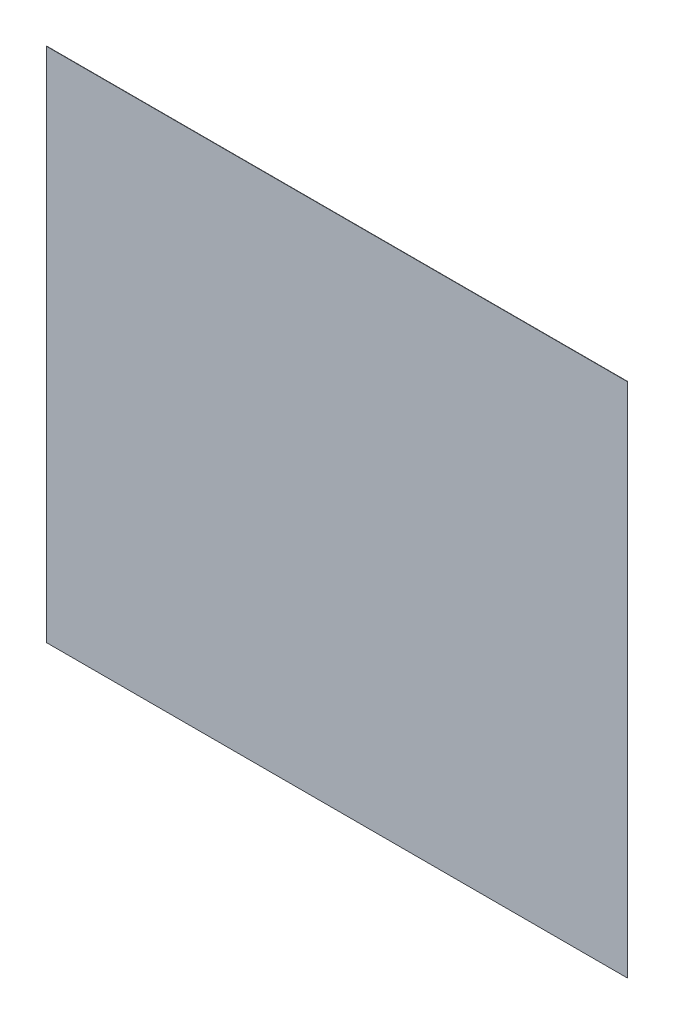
SolidWorks part; units mm, degrees
ref_plane "Alzado" through (0, 0, 0) normal (0, 0, 1) x (1, 0, 0)
ref_plane "Planta" through (0, 0, 0) normal (0, 1, 0) x (1, 0, 0)
ref_plane "Vista lateral" through (0, 0, 0) normal (1, 0, 0) x (0, 0, -1)
sketch "Croquis1" plane through (0, 0, 0) normal (0, 0, 1) x (1, 0, 0)
  line L1 (-90, -80) -> (90, -80)
  line L2 (-90, -80) -> (-90, 80)
  line L3 (-90, 80) -> (90, 80)
  line L4 (90, -80) -> (90, 80)
  line L5 (-90, -80) -> (90, 80) construction
  line L6 (-90, 80) -> (90, -80) construction
  point P0 (0, 0)
  dimension "D1" = 180
  dimension "D2" = 160
extrude "Saliente-Extruir1" add sketch "Croquis1" along normal blind 0.1
